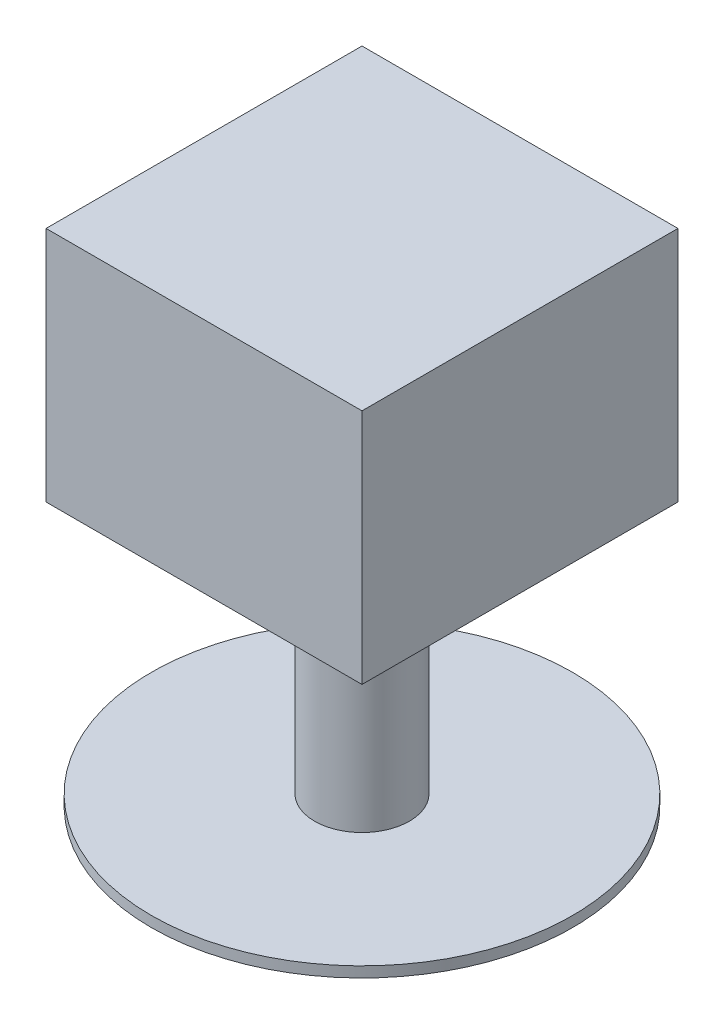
SolidWorks part; units mm, degrees
ref_plane "Plan de face" through (0, 0, 0) normal (0, 0, 1) x (1, 0, 0)
ref_plane "Plan de dessus" through (0, 0, 0) normal (0, 1, 0) x (1, 0, 0)
ref_plane "Plan de droite" through (0, 0, 0) normal (1, 0, 0) x (0, 0, -1)
sketch "Esquisse1" plane through (0, 0, 0) normal (0, 0, 1) x (1, 0, 0)
  line L0 (0, -16) -> (0, -20)
  line L1 (13.8564, 8) -> (17.3205, 10)
  line L2 (0, 21.4112) -> (0, -23.3838) construction
  arc A0 (0, -16) -> (13.8564, 8) centre (0, 0) ccw
  arc A1 (0, -20) -> (17.3205, 10) centre (0, 0) ccw
  dimension "D1" = 120
  dimension "D2" = 20
ref_plane "Plan1" through (0, -70, 0) normal (0, 1, 0) x (-1, 0, 0)
sketch "Esquisse2" plane through (0, -70, 0) normal (0, 1, 0) x (-1, 0, 0)
  circle A0 centre (0, 0) radius 40
extrude "Boss.-Extru.2" add sketch "Esquisse2" along normal blind 2 separate body
sketch "Esquisse3" plane through (0, -68, 0) normal (0, 1, 0) x (1, 0, 0)
  circle A0 centre (0, 0) radius 9
ref_plane "Plan2" through (0, -20, 0) normal (0, 1, 0) x (-1, 0, 0)
sketch "Esquisse4" plane through (0, -20, 0) normal (0, 1, 0) x (-1, 0, 0)
  line L1 (-30, 30) -> (30, 30)
  line L2 (-30, 30) -> (-30, -30)
  line L3 (-30, -30) -> (30, -30)
  line L4 (30, 30) -> (30, -30)
extrude "Boss.-Extru.3" add sketch "Esquisse4" along normal blind 45 separate body
extrude "Boss.-Extru.4" add sketch "Esquisse3" along normal up to surface (48 mm away)
sketch "Esquisse5" plane through (0, 0, 0) normal (0, 0, 1) x (1, 0, 0)
  line L0 (0, 12.436) -> (0, -45.3371)
  line L1 (0, 21.4112) -> (0, -23.3838) construction
